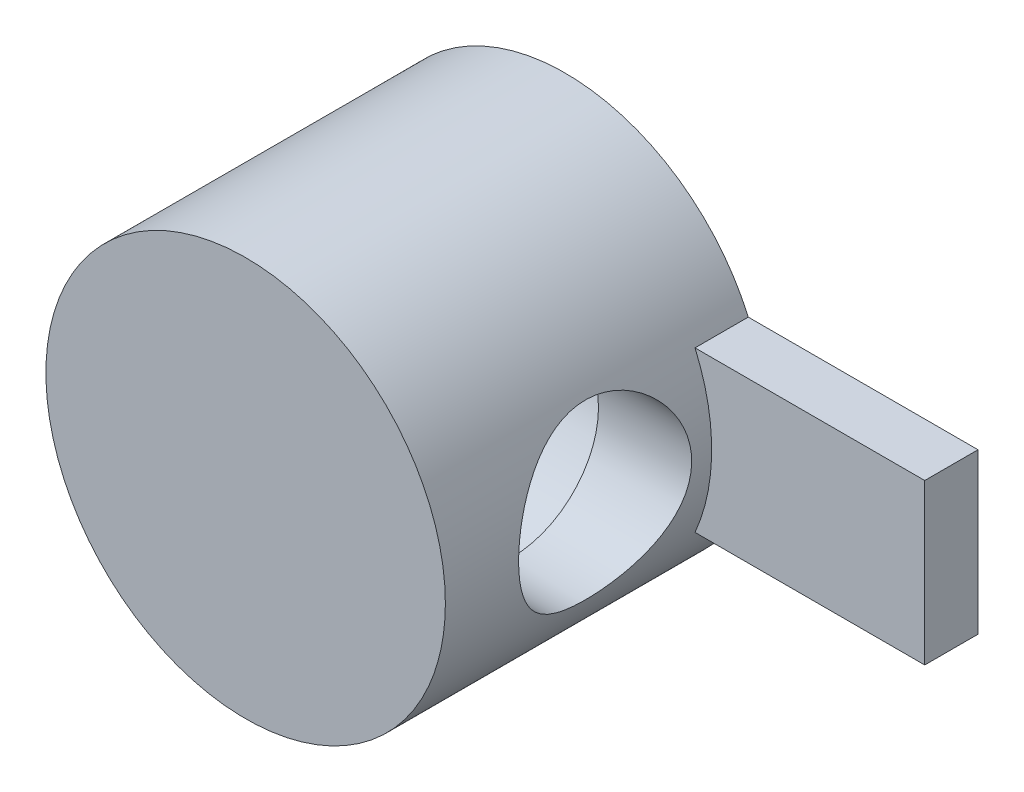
SolidWorks part; units mm, degrees
ref_plane "前视基准面" through (0, 0, 0) normal (0, 0, 1) x (1, 0, 0)
ref_plane "上视基准面" through (0, 0, 0) normal (0, 1, 0) x (1, 0, 0)
ref_plane "右视基准面" through (0, 0, 0) normal (1, 0, 0) x (0, 0, -1)
sketch "草图1" plane through (0, 0, 0) normal (0, 0, 1) x (1, 0, 0)
  circle A0 centre (0, 0) radius 7.5
extrude "凸台-拉伸1" add sketch "草图1" along normal mid plane 12
sketch "草图2" plane through (0, 0, -6) normal (0, 0, -1) x (-1, 0, 0)
  line L0 (0, 7.9338) -> (0, -8.6248) construction
  line L1 (-9.2787, 0) -> (10.784, 0) construction
  line L3 (-6.8739, 3) -> (-15.5, 3)
  line L4 (-15.5, 3) -> (-15.5, -3)
  line L5 (-15.5, -3) -> (-6.8739, -3)
  circle A0 centre (0, 0) radius 7.5 construction
  arc A1 (-6.8739, 3) -> (-6.8739, -3) centre (0, 0) ccw
  dimension "D3" = 15.5
extrude "凸台-拉伸2" add sketch "草图2" against normal blind 2
sketch "草图3" plane through (0, 0, 0) normal (1, 0, 0) x (0, 0, -1)
  circle A0 centre (0, 0) radius 3.25
  dimension "D1" = 6.5
extrude "切除-拉伸1" cut sketch "草图3" against normal mid plane 20
sketch "草图4" plane through (0, 0, 0) normal (1, 0, 0) x (0, 0, -1)
  circle A0 centre (0, 0) radius 5
  dimension "D1" = 10
extrude "切除-拉伸2" cut sketch "草图4" against normal blind 20
sketch "草图5" plane through (0, 0, 0) normal (1, 0, 0) x (0, 0, -1)
  circle A0 centre (0, 0) radius 5
  dimension "D1" = 10
extrude "切除-拉伸3" cut sketch "草图5" along normal blind 4
